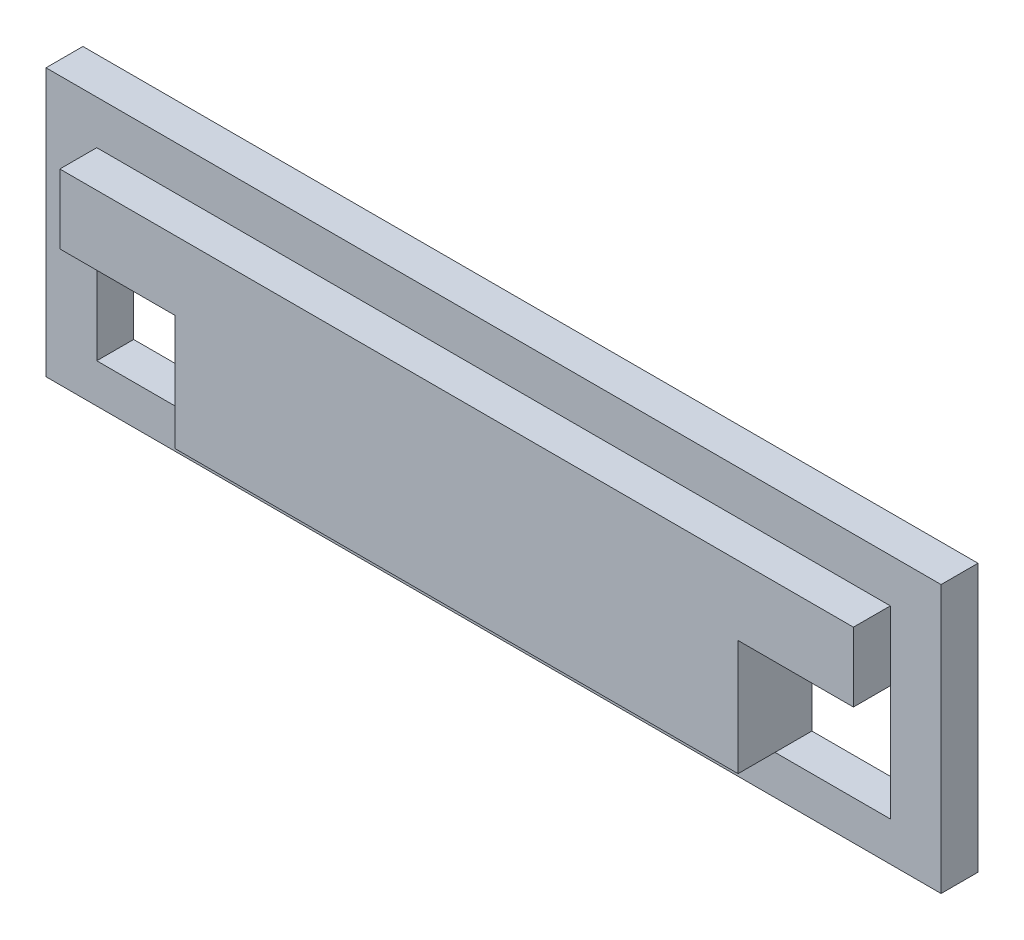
SolidWorks part; units mm, degrees
ref_plane "Front Plane" through (0, 0, 0) normal (0, 0, 1) x (1, 0, 0)
ref_plane "Top Plane" through (0, 0, 0) normal (0, 1, 0) x (1, 0, 0)
ref_plane "Right Plane" through (0, 0, 0) normal (1, 0, 0) x (0, 0, -1)
sketch "Sketch1" plane through (0, 0, 0) normal (0, 0, 1) x (1, 0, 0)
  line L1 (0, 0) -> (19.4, 0)
  line L2 (0, 0) -> (0, 5.8)
  line L3 (0, 5.8) -> (19.4, 5.8)
  line L4 (19.4, 0) -> (19.4, 5.8)
  dimension "D1" = 19.4
  dimension "D2" = 5.8
extrude "Boss-Extrude1" add sketch "Sketch1" along normal blind 0.8
sketch "Sketch2" plane through (0, 0, 0.8) normal (0, 0, 1) x (1, 0, 0)
  line L0 (19.4, 5.8) -> (0, 5.8) construction
  line L1 (1.1, 4.85) -> (18.3, 4.85)
  line L2 (1.1, 4.85) -> (1.1, 0.85)
  line L3 (1.1, 0.85) -> (18.3, 0.85)
  line L4 (18.3, 4.85) -> (18.3, 0.85)
  line L5 (0, 0) -> (19.4, 0) construction
  line L6 (0, 5.8) -> (0, 0) construction
  line L7 (19.4, 0) -> (19.4, 5.8) construction
  dimension "D1" = 0.95
  dimension "D2" = 0.85
  dimension "D3" = 1.1
  dimension "D4" = 1.1
extrude "Boss-Extrude2" add sketch "Sketch2" along normal blind 0.8
sketch "Sketch3" plane through (0, 0, 0) normal (0, 0, -1) x (-1, 0, 0)
  line L0 (0, 0) -> (-19.4, 0) construction
  line L1 (-18.3, 0.85) -> (-15.8, 0.85)
  line L2 (-18.3, 0.85) -> (-18.3, 3.35)
  line L3 (-18.3, 3.35) -> (-15.8, 3.35)
  line L4 (-15.8, 0.85) -> (-15.8, 3.35)
  line L5 (-3.6, 3.35) -> (-1.1, 3.35)
  line L6 (-3.6, 3.35) -> (-3.6, 0.85)
  line L7 (-3.6, 0.85) -> (-1.1, 0.85)
  line L8 (-1.1, 3.35) -> (-1.1, 0.85)
  line L9 (-19.4, 0) -> (-19.4, 5.8) construction
  line L10 (0, 5.8) -> (0, 0) construction
  point P10 (0, 0)
  point P11 (0, 0)
  dimension "D1" = 0.85
  dimension "D2" = 1.1
  dimension "D3" = 1.1
  dimension "D4" = 2.5
  dimension "D5" = 2.5
  dimension "D6" = 2.5
extrude "Cut-Extrude2" cut sketch "Sketch3" against normal blind 10.8
